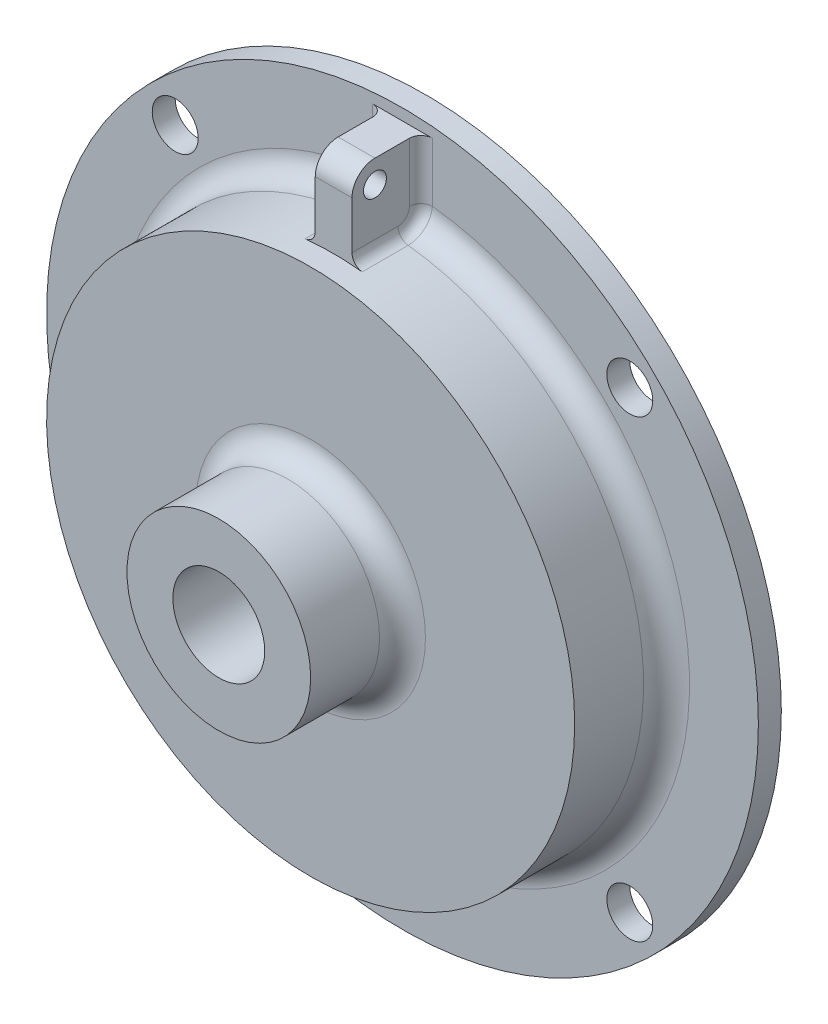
SolidWorks part; units mm, degrees
ref_plane "Front" through (0, 0, 0) normal (0, 0, 1) x (1, 0, 0)
ref_plane "Top" through (0, 0, 0) normal (0, 1, 0) x (1, 0, 0)
ref_plane "Right" through (0, 0, 0) normal (1, 0, 0) x (0, 0, -1)
sketch "Sketch1" plane through (0, 0, 0) normal (0, 0, 1) x (1, 0, 0)
  circle A0 centre (0, 0) radius 49.2125
  dimension "D1" = 98.425
extrude "Base-Extrude" add sketch "Sketch1" along normal blind 3.175
sketch "Sketch5" plane through (0, 0, 3.175) normal (0, 0, 1) x (1, 0, 0)
  line L0 (31.4309, 31.4309) -> (0, 0) construction
  line L1 (0, 0) -> (44.45, 0) construction
  circle A0 centre (0, 0) radius 44.45 construction
  circle A1 centre (31.4309, 31.4309) radius 3.175
  dimension "D1" = 88.9
  dimension "D2" = 6.35
  dimension "D3" = 45
extrude "Cut-Extrude2" cut sketch "Sketch5" against normal through all
pattern_circular "CirPattern1" count 4 every 90 about axis through (0, 0, 0) along (0, 0, 1) of "Cut-Extrude2"
sketch "Sketch2" plane through (0, 0, 3.175) normal (0, 0, 1) x (1, 0, 0)
  circle A0 centre (0, 0) radius 36.5125
  dimension "D1" = 73.025
extrude "Boss-Extrude1" add sketch "Sketch2" along normal blind 12.7
sketch "Sketch3" plane through (0, 0, 15.875) normal (0, 0, 1) x (1, 0, 0)
  circle A0 centre (0, 0) radius 12.7
  dimension "D1" = 25.4
extrude "Boss-Extrude2" add sketch "Sketch3" along normal blind 12.7
fillet "Fillet1" radius 3.175 2 edges at (36.5125, 0, 3.175) (12.7, 0, 15.875)
sketch "Sketch6" plane through (0, 0, 0) normal (0, 1, 0) x (1, 0, 0)
  line L0 (-2.54, -3.175) -> (-2.54, -12.7)
  line L1 (-39.6875, -3.175) -> (39.6875, -3.175) construction
  line L2 (-2.54, -3.175) -> (2.54, -3.175)
  line L3 (-49.2125, -3.175) -> (49.2125, -3.175) construction
  line L4 (2.54, -3.175) -> (2.54, -12.7)
  line L5 (-2.54, -12.7) -> (2.54, -12.7)
  line L6 (0, 0) -> (0, -38.11) construction
  line L7 (0, -3.175) -> (0, 0) construction
  dimension "D1" = 5.08
  dimension "D2" = 9.525
extrude "Boss-Extrude3" add sketch "Sketch6" along normal blind 47.625
sketch "Sketch4" plane through (0, 0, 28.575) normal (0, 0, 1) x (1, 0, 0)
  circle A0 centre (0, 0) radius 6.35
  dimension "D1" = 12.7
extrude "Cut-Extrude1" cut sketch "Sketch4" against normal through all
fillet "Fillet2" radius 3.175 1 edges at (0, 47.625, 12.7)
sketch "Sketch7" plane through (2.54, 0, 0) normal (1, 0, 0) x (0, 0, -1)
  circle A0 centre (-9.525, 44.45) radius 1.5875
  arc A1 (-9.525, 47.625) -> (-12.7, 44.45) centre (-9.525, 44.45) ccw construction
  dimension "D1" = 3.175
extrude "Cut-Extrude3" cut sketch "Sketch7" against normal up to next
fillet "Fillet3" radius 1.5875 6 edges at (2.54, 41.6917, 8.7475) (-2.54, 41.6917, 8.7475) (2.54, 43.6156, 3.175) (-2.54, 36.424, 9.525) (-2.54, 43.6156, 3.175) (2.54, 36.424, 9.525)
